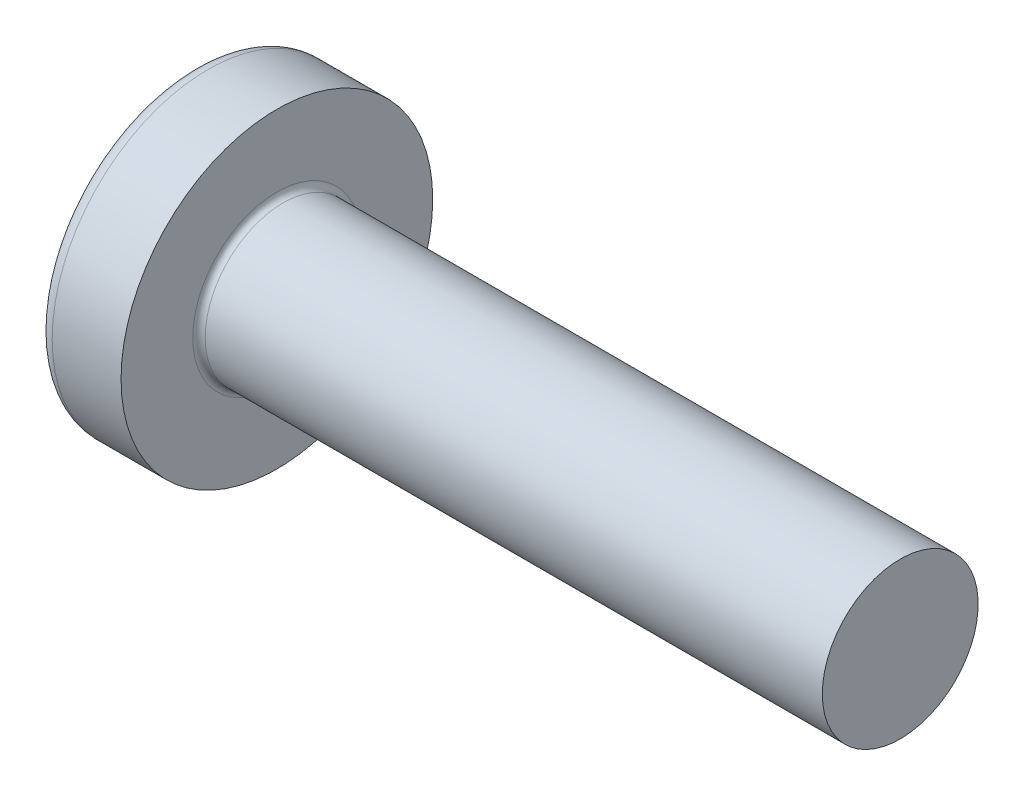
SolidWorks part; units mm, degrees
ref_plane "Plane1" through (0, 0, 0) normal (0, 0, 1) x (1, 0, 0)
ref_plane "Plane2" through (0, 0, 0) normal (0, 1, 0) x (1, 0, 0)
ref_plane "Plane3" through (0, 0, 0) normal (1, 0, 0) x (0, 0, -1)
revolve "Base-Revolve" add sketch "BodySke"
sketch "BodySke" plane through (0, 0, 0) normal (0, 0, 1) x (1, 0, 0)
  line L0 (2.1, 1.25) -> (2.1, 2.5)
  line L1 (2.325, 6.35) -> (2.325, -3.175) construction
  line L2 (-25.4, 0) -> (127, 0) construction
  line L3 (12.1, 0) -> (0, 0)
  line L4 (2.1, 1.25) -> (12.1, 1.25)
  line L5 (12.1, 1.25) -> (12.1, 0)
  line L6 (0.995, 2.5) -> (2.1, 2.5)
  line L8 (2.1, 6.35) -> (2.1, -3.175) construction
  arc A0 (0.8032, 2.4043) -> (0, 0) centre (4, 0) ccw
  arc A2 (0.8032, 2.4043) -> (0.995, 2.5) centre (0.995, 2.26) cw
  dimension "Head_fillet_rad" = 0.24
  dimension "Head_crown_rad" = 4
  dimension "Head_ht" = 2.1
  dimension "Diameter" = 2.5
  dimension "Length" = 10
  dimension "Head_dia" = 5
  dimension "Advance" = 0.45
  dimension "Thread_nom" = 10
fillet "Fillet1" radius 0.1 1 edges at (2.1, 0, 1.25)
sketch "Sketch3" plane through (0, 0, 0) normal (1, 0, 0) x (0, 0, -1)
  line L0 (0.37, -1.3) -> (-0.37, -1.3)
  line L1 (0.37, -1.3) -> (0.37, 1.3)
  line L2 (-0.37, 1.3) -> (0.37, 1.3)
  line L3 (-0.37, 1.3) -> (-0.37, -1.3)
  dimension "D1" = 1.3
  dimension "Cross_dia" = 2.6
  dimension "D2" = 0.37
  dimension "Cross_width" = 0.74
ref_plane "Plane4" through (1.5, 0, 0) normal (1, 0, 0) x (0, 0, -1)
sketch "Sketch4" plane through (1.5, 0, 0) normal (1, 0, 0) x (0, 0, -1)
  line L0 (0.37, -0.5521) -> (-0.37, -0.5521)
  line L1 (0.37, -0.5521) -> (0.37, 0.5521)
  line L2 (-0.37, 0.5521) -> (0.37, 0.5521)
  line L3 (-0.37, 0.5521) -> (-0.37, -0.5521)
  dimension "D1" = 0.74
  dimension "D2" = 1.1043
  dimension "D3" = 0.37
  dimension "D4" = 0.5521
loft "Recess" cut profiles "Sketch3", "Sketch4"
pattern_circular "RecPat" count 2 every 90 about axis through (0, 0, 0) along (1, 0, 0) of "Recess"
sketch "RecCorSke" plane through (0, 0, 0) normal (0, 0, 1) x (1, 0, 0)
  line L0 (-3.175, 0) -> (15.875, 0) construction
  line L1 (-25.4, 0) -> (127, 0) construction
  line L2 (0, 0) -> (0, 0.6609)
  line L3 (0, 0.6609) -> (1.5, 0.556)
  line L4 (1.5, 0.556) -> (1.6807, 0)
  line L5 (1.6807, 0) -> (0, 0)
  dimension "Diameter" = 1.112
  dimension "Depth" = 1.5
  dimension "Draft_angle" = 4
  dimension "Bottom_angle" = 18
revolve "RecessCore" cut sketch "RecCorSke" angle 360 about L0
sketch "ThdSchSke" plane through (0, 0, 0) normal (0, 0, 1) x (1, 0, 0)
  line L0 (3, -0.9965) -> (2.8225, -1.25)
  line L1 (3, -0.9965) -> (3.1775, -1.25)
  line L2 (3.1775, -1.25) -> (3.1775, -1.5625)
  line L3 (-3.175, 0) -> (5.1513, 0) construction
  line L5 (3.1775, -1.5625) -> (2.8225, -1.5625)
  line L6 (2.8225, -1.5625) -> (2.8225, -1.25)
  dimension "Thread_minor" = 1.993
  dimension "Diameter" = 2.5
  dimension "Start" = 3
  dimension "SideAngle" = 55
  dimension "VeeAngle" = 70
  dimension "Overcut" = 3.125
revolve "ThreadSchematic" cut sketch "ThdSchSke" angle 360 about L3
pattern_linear "ThdSchPat"
equation "\"D1@Sketch3\" = \"Cross_dia@Sketch3\" / 2"
equation "\"D2@Sketch3\" = \"Cross_width@Sketch3\" / 2"
equation "\"Depth@RecCorSke\" = \"Cross_depth@Plane4\""
equation "\"D1@Sketch4\" = \"Cross_width@Sketch3\""
equation "\"D2@Sketch4\" = \"Cross_dia@Sketch3\" - 2.0 * \"Cross_depth@Plane4\" * tan(26.5  * 0.017453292)"
equation "\"D3@Sketch4\" = \"D1@Sketch4\" / 2"
equation "\"D4@Sketch4\" = \"D2@Sketch4\" / 2"
equation "\"Thread_length@ThreadCosmetic\" = ((sgn( (\"Length@BodySke\" - \"Advance@BodySke\" * 2.0 ) - \"Thread_nom@BodySke\" )-1)*( (\"Length@BodySke\" - \"Advance@BodySke\" * 2.0 ) - \"Thread_nom@BodySke\" ))/-2+ \"Thread_"
equation "\"Thread_minor@ThdSchSke\" = \"Thread_minor@ThreadCosmetic\""
equation "\"Diameter@ThdSchSke\" = \"Diameter@BodySke\""
equation "\"Overcut@ThdSchSke\" = \"Diameter@BodySke\" * 1.25"
equation "\"Start@ThdSchSke\" = \"Head_ht@BodySke\" + \"Length@BodySke\" - \"Thread_length@ThreadCosmetic\"  '---Non-countersunk---"
equation "\"Num_threads@ThdSchPat\" = int( \"Thread_length@ThreadCosmetic\" / \"Advance@BodySke\" + 0.999 )  + 1"
equation "\"Advance@ThdSchPat\" = \"Thread_length@ThreadCosmetic\" /  (\"Num_threads@ThdSchPat\" - 1) 'relax it"
